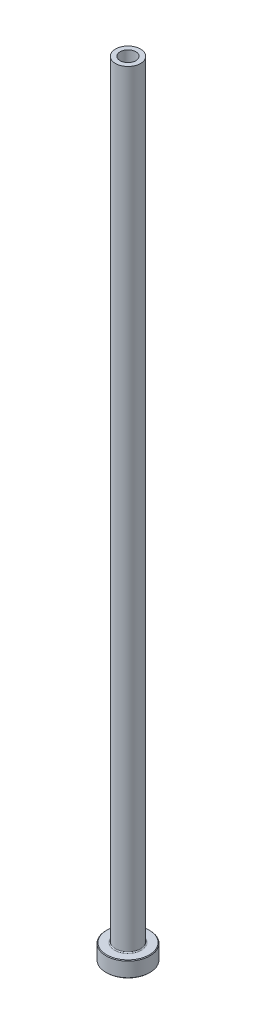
SolidWorks part; units mm, degrees
ref_plane "Front Plane" through (0, 0, 0) normal (0, 0, 1) x (1, 0, 0)
ref_plane "Top Plane" through (0, 0, 0) normal (0, 1, 0) x (1, 0, 0)
ref_plane "Right Plane" through (0, 0, 0) normal (1, 0, 0) x (0, 0, -1)
sketch "Sketch1" plane through (0, 0, 0) normal (0, 0, 1) x (1, 0, 0)
  line L0 (-2.5, 250) -> (-4, 250)
  line L1 (-4, 250) -> (-4, 5)
  line L2 (-4, 5) -> (-7, 5)
  line L3 (-7, 5) -> (-7, 0)
  line L4 (7.7, 0) -> (-7.7, 0) construction
  line L5 (-7, 0) -> (-2.75, 0)
  line L6 (-2.5, 205) -> (-2.5, 250)
  line L7 (0, 92.1877) -> (0, -15.5353) construction
  line L8 (0, -7.7) -> (0, 7.7) construction
  line L9 (-2.5, 205) -> (-2.75, 193)
  line L10 (-2.75, 193) -> (-2.75, 0)
  dimension "D1" = 0.25
  dimension "ID" = 5
  dimension "OD" = 8
  dimension "L" = 250
  dimension "H" = 14
  dimension "T" = 5
  dimension "N" = 45
  dimension "D2" = 12
revolve "Revolve1" add sketch "Sketch1" angle 360 about L7
fillet "Fillet1" radius 0.3 1 edges at (0, 5, 4)
chamfer "Chamfer1" distance 0.2 angle 45 2 edges at (0, 5, 7) (0, 0, 7)
chamfer "Chamfer3" distance 0.5 angle 45 1 edges at (0, 0, 2.75)
